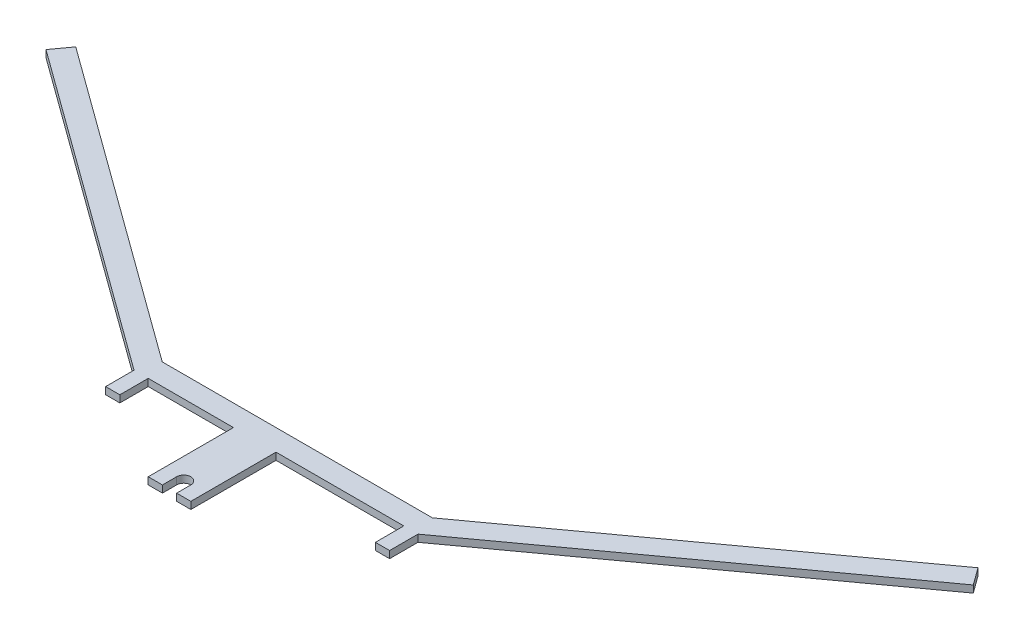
SolidWorks part; units mm, degrees
ref_plane "前视基准面" through (0, 0, 0) normal (0, 0, 1) x (1, 0, 0)
ref_plane "上视基准面" through (0, 0, 0) normal (0, 1, 0) x (1, 0, 0)
ref_plane "右视基准面" through (0, 0, 0) normal (1, 0, 0) x (0, 0, -1)
sketch "草图1" plane through (0, 0, 0) normal (0, 1, 0) x (1, 0, 0)
  line L0 (0, 0) -> (0, -51.4782) construction
  line L1 (-31.7734, -28.8317) -> (-9.5127, -45)
  line L2 (-9.5127, -45) -> (9.5127, -45)
  line L3 (-31.7734, -28.8317) -> (-32.6549, -30.0454)
  line L4 (-32.6549, -30.0454) -> (-10, -46.5)
  line L5 (-10, -46.5) -> (10, -46.5)
  line L6 (31.7734, -28.8317) -> (32.6549, -30.0454)
  line L7 (31.7734, -28.8317) -> (9.5127, -45)
  line L8 (32.6549, -30.0454) -> (10, -46.5)
  circle A0 centre (0, 0) radius 42 construction
  point P8 (0, -42)
  point P14 (0, -46.5)
  point P15 (0, -45)
  dimension "D1" = 84
  dimension "D2" = 20
  dimension "D3" = 3
  dimension "D4" = 1.5
  dimension "D5" = 1.5
  dimension "D6" = 28
extrude "凸台-拉伸1" add sketch "草图1" along normal mid plane 0.5
sketch "草图2" plane through (0, 0.25, 0) normal (0, 1, 0) x (1, 0, 0)
  line L0 (0, -45) -> (0, -49.7255) construction
  line L1 (9.5127, -45) -> (-9.5127, -45) construction
  line L2 (-10, -46.5) -> (10, -46.5) construction
  line L3 (-10, -46.5) -> (-9, -46.5)
  line L4 (-10, -46.5) -> (-10, -48.5)
  line L5 (-10, -48.5) -> (-9, -48.5)
  line L6 (-9, -46.5) -> (-9, -48.5)
  line L7 (10, -48.5) -> (9, -48.5)
  line L8 (9, -46.5) -> (9, -48.5)
  line L9 (10, -46.5) -> (9, -46.5)
  line L10 (10, -46.5) -> (10, -48.5)
  point P11 (-9.5, -48.5)
  dimension "D1" = 1
  dimension "D2" = 2
extrude "凸台-拉伸2" add sketch "草图2" against normal up to surface (0.5 mm away)
sketch "草图5" plane through (0, -0.25, 0) normal (0, -1, 0) x (1, 0, 0)
  line L1 (9, 46.5) -> (13.5371, 46.5)
  line L2 (9, 46.5) -> (9, 50.8222)
  line L3 (9, 50.8222) -> (13.5371, 50.8222)
  line L4 (13.5371, 46.5) -> (13.5371, 50.8222)
extrude "切除-拉伸1" cut sketch "草图5" against normal through all
sketch "草图6" plane through (0, -0.25, 0) normal (0, -1, 0) x (1, 0, 0)
  line L0 (-9, 46.5) -> (10, 46.5) construction
  line L1 (0, 46.5) -> (-3, 46.5)
  line L2 (0, 46.5) -> (0, 52.5)
  line L3 (0, 52.5) -> (-3, 52.5)
  line L4 (-3, 46.5) -> (-3, 52.5)
  line L5 (10, 46.5) -> (10, 49.9674) construction
  dimension "D1" = 6
  dimension "D2" = 3
  dimension "D3" = 10
extrude "凸台-拉伸3" add sketch "草图6" against normal up to surface (0.5 mm away)
sketch "草图7" plane through (0, -0.25, 0) normal (0, -1, 0) x (1, 0, 0)
  line L0 (-1.5, 52.5) -> (-1.5, 51.5) construction
  line L1 (0, 52.5) -> (-3, 52.5) construction
  line L2 (-2, 51.5) -> (-2, 55.2784)
  line L3 (-2, 55.2784) -> (-1, 55.2784)
  line L4 (-1, 55.2784) -> (-1, 51.5)
  arc A0 (-2, 51.5) -> (-1, 51.5) centre (-1.5, 51.5) ccw
  dimension "D1" = 1
  dimension "D2" = 1
extrude "切除-拉伸2" cut sketch "草图7" against normal through all
sketch "草图8" plane through (0, -0.25, 0) normal (0, -1, 0) x (1, 0, 0)
  line L0 (10, 46.5) -> (10, 48.5)
  line L1 (10, 48.5) -> (9, 48.5)
  line L2 (9, 48.5) -> (9, 46.5)
  line L3 (0, 46.5) -> (10, 46.5) construction
  line L5 (9, 46.5) -> (10, 46.5)
  dimension "D1" = 1
  dimension "D2" = 2
extrude "凸台-拉伸4" add sketch "草图8" against normal up to surface (0.5 mm away)
